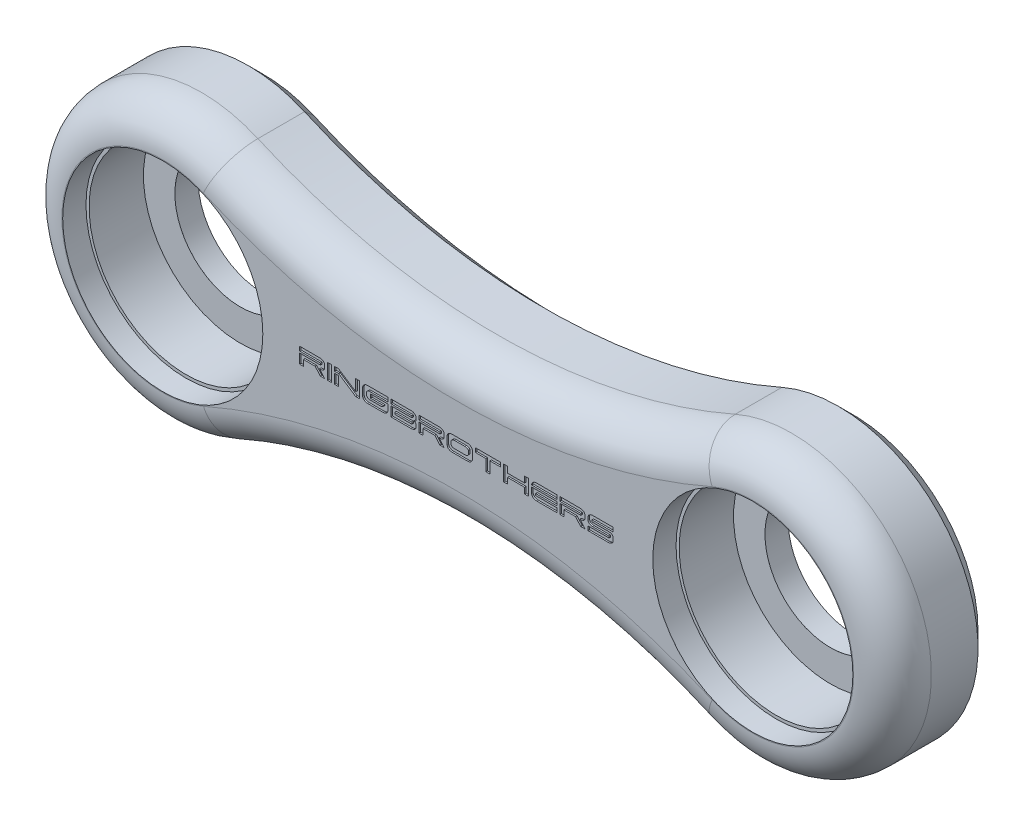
SolidWorks part; units mm, degrees
ref_plane "Front Plane" through (0, 0, 0) normal (0, 0, 1) x (1, 0, 0)
ref_plane "Top Plane" through (0, 0, 0) normal (0, 1, 0) x (1, 0, 0)
ref_plane "Right Plane" through (0, 0, 0) normal (1, 0, 0) x (0, 0, -1)
sketch "Sketch1" plane through (0, 0, 0) normal (0, 0, 1) x (1, 0, 0)
  line L0 (-11.43, 0) -> (59.69, 0) construction
  line L1 (-11.43, 6.35) -> (59.69, 6.35) construction
  arc A0 (4.6084, 10.4598) -> (4.6084, -10.4598) centre (0, 0) ccw
  arc A1 (43.6516, -10.4598) -> (43.6516, 10.4598) centre (48.26, 0) ccw
  arc A2 (4.6084, 10.4598) -> (43.6516, 10.4598) centre (24.13, 54.7687) ccw
  arc A3 (4.6084, -10.4598) -> (43.6516, -10.4598) centre (24.13, -54.7687) cw
  circle A4 centre (0, 0) radius 5.3594
  circle A5 centre (48.26, 0) radius 5.3594
  dimension "D1" = 22.86
  dimension "D4" = 10.7188
  dimension "D2" = 48.26
  dimension "D3" = 6.35
extrude "Main Body Dog Bone" add sketch "Sketch1" against normal blind 8.255
sketch "Sketch2" plane through (0, 0, 0) normal (0, 0, 1) x (1, 0, 0)
  circle A0 centre (0, 0) radius 7.9311
  circle A1 centre (48.26, 0) radius 7.9312
  dimension "D1" = 15.8623
extrude "R4ZZ bearin bore .3\" deep" cut sketch "Sketch2" against normal blind 6.35
sketch "Sketch3" plane through (0, 0, 0) normal (0, 0, 1) x (1, 0, 0)
  circle A2 centre (0, 0) radius 8.1852
  circle A3 centre (0, 0) radius 8.1852
  circle A5 centre (48.26, 0) radius 8.1852
  circle A6 centre (48.26, 0) radius 8.1852
  dimension "D1" = 0.254
  dimension "D2" = 0.254
extrude ".105\" deep Clearance Bore" cut sketch "Sketch3" against normal blind 1.905
chamfer ".02\" x 45 deg chamfers" distance 0.0003 angle 45 6 edges at (53.6194, 0, -8.255) (53.6194, 0, -6.35) (56.4451, 0, 0) (5.3594, 0, -8.255) (5.3594, 0, -6.35) (8.1852, 0, 0)
fillet ".125\" Fillets" radius 3.175 4 edges at (24.13, 6.35, 0) (24.13, -6.35, 0) (59.69, 0, 0) (-11.43, 0, 0)
sketch "Sketch4" [suppressed] plane through (0, 0, 0) normal (0, 0, 1) x (1, 0, 0)
  arc A3 (9.8505, 1.4938) -> (11.8659, 3.3473) centre (11.4829, 1.7413) cw
  arc A5 (43.0465, -5.4054) -> (5.2135, -5.4054) centre (24.13, -54.7687) ccw
  arc A6 (36.3941, -3.3473) -> (11.8659, -3.3473) centre (24.13, -54.7687) ccw
  arc A8 (6.496, -7.5542) -> (6.496, 7.5542) centre (0, 0) ccw
  arc A9 (9.8505, -1.4938) -> (9.8505, 1.4938) centre (0, 0) ccw
  arc A10 (5.2135, 5.4054) -> (43.0465, 5.4054) centre (24.13, 54.7687) ccw
  arc A11 (41.764, 7.5542) -> (41.764, -7.5542) centre (48.26, 0) ccw
  arc A12 (38.4095, 1.4938) -> (38.4095, -1.4938) centre (48.26, 0) ccw
  arc A13 (11.8659, 3.3473) -> (36.3941, 3.3473) centre (24.13, 54.7687) ccw
  arc A14 (11.8659, -3.3473) -> (9.8505, -1.4938) centre (11.4829, -1.7413) cw
  arc A15 (38.4095, -1.4938) -> (36.3941, -3.3473) centre (36.7771, -1.7413) cw
  arc A16 (38.4095, 1.4938) -> (36.3941, 3.3473) centre (36.7771, 1.7413) ccw
  dimension "D5" = 1.651
  dimension "D1" = 1.27
  dimension "D2" = 1.27
  dimension "D3" = 1.27
  dimension "D4" = 1.27
extrude "Extrude1" [suppressed] cut sketch "Sketch4" against normal blind 2.54
fillet ".03\" Fillets" [suppressed] radius 0.762
chamfer "Chamfer1" distance 1.27 angle 45 4 edges at (24.13, 6.35, -8.255) (-11.43, 0, -8.255) (59.69, 0, -8.255) (24.13, -6.35, -8.255)
sketch "Sketch5" plane through (0, 0, 0) normal (0, 0, 1) x (1, 0, 0)
  line L0 (0, 0) -> (48.26, 0) construction
  line L1 (0, -0.635) -> (48.26, -0.635) construction
  line L2 (0, 0.635) -> (48.26, 0.635) construction
  text T0 "RINGBROTHERS" font "Dodger" height 1.27
  dimension "D1" = 0.635
  dimension "D2" = 0.635
extrude "Extrude2" cut sketch "Sketch5" against normal blind 0.127
sketch "Sketch6" plane through (0, 0, 0) normal (0, 0, 1) x (1, 0, 0)
  arc A8 (4.6084, 10.4598) -> (4.6084, -10.4598) centre (0, 0) ccw construction
  arc A9 (4.6084, 10.4598) -> (43.6516, 10.4598) centre (24.13, 54.7687) ccw construction
  arc A10 (43.6516, -10.4598) -> (43.6516, 10.4598) centre (48.26, 0) ccw construction
  arc A11 (43.6516, -10.4598) -> (4.6084, -10.4598) centre (24.13, -54.7687) ccw construction
  arc A12 (4.6084, 10.4598) -> (4.6084, -10.4598) centre (0, 0) ccw
  arc A13 (4.6084, 10.4598) -> (43.6516, 10.4598) centre (24.13, 54.7687) ccw
  arc A14 (43.6516, -10.4598) -> (43.6516, 10.4598) centre (48.26, 0) ccw
  arc A15 (43.6516, -10.4598) -> (4.6084, -10.4598) centre (24.13, -54.7687) ccw
sketch "Sketch7" plane through (0, 0, -6.35) normal (0, 0, 1) x (1, 0, 0)
  circle A0 centre (0, 0) radius 5.3594 construction
  circle A1 centre (0, 0) radius 5.3594
sketch "Sketch8" plane through (0, 0, -6.35) normal (0, 0, 1) x (1, 0, 0)
  circle A0 centre (48.26, 0) radius 5.3594 construction
  circle A1 centre (48.26, 0) radius 5.3594
sketch "Sketch9" plane through (0, 0, 0) normal (0, 0, 1) x (1, 0, 0)
  circle A0 centre (48.26, 0) radius 8.1852 construction
  circle A1 centre (48.26, 0) radius 8.1852
sketch "Sketch10" plane through (0, 0, 0) normal (0, 0, 1) x (1, 0, 0)
  circle A0 centre (0, 0) radius 8.1852 construction
  circle A1 centre (0, 0) radius 8.1852
sketch "Sketch11" plane through (0, 0, -8.255) normal (0, 0, -1) x (-1, 0, 0)
  arc A0 (-43.6516, 10.4598) -> (-4.6084, 10.4598) centre (-24.13, 54.7687) ccw construction
  arc A1 (-43.6516, 10.4598) -> (-43.6516, -10.4598) centre (-48.26, 0) ccw construction
  arc A2 (-4.6084, -10.4598) -> (-43.6516, -10.4598) centre (-24.13, -54.7687) ccw construction
  arc A3 (-4.6084, -10.4598) -> (-4.6084, 10.4598) centre (0, 0) ccw construction
  arc A4 (-43.6516, 10.4598) -> (-4.6084, 10.4598) centre (-24.13, 54.7687) ccw
  arc A5 (-43.6516, 10.4598) -> (-43.6516, -10.4598) centre (-48.26, 0) ccw
  arc A6 (-4.6084, -10.4598) -> (-43.6516, -10.4598) centre (-24.13, -54.7687) ccw
  arc A7 (-4.6084, -10.4598) -> (-4.6084, 10.4598) centre (0, 0) ccw
sketch "Sketch12" plane through (0, 0, -8.255) normal (0, 0, -1) x (-1, 0, 0)
  circle A0 centre (0, 0) radius 5.3594 construction
  circle A1 centre (0, 0) radius 5.3594
sketch "Sketch13" plane through (0, 0, -8.255) normal (0, 0, -1) x (-1, 0, 0)
  circle A0 centre (-48.26, 0) radius 5.3594 construction
  circle A1 centre (-48.26, 0) radius 5.3594
sketch "Sketch14" plane through (0, 0, 0) normal (0, 0, 1) x (1, 0, 0)
  point P0 (0, 0)
  point P1 (48.26, 0)
sketch "Sketch16" plane through (0, 0, -8.255) normal (0, 0, -1) x (-1, 0, 0)
  line L1 (-100.33, 20.6375) -> (52.07, 20.6375)
  line L2 (-100.33, 20.6375) -> (-100.33, -20.6375)
  line L3 (-100.33, -20.6375) -> (52.07, -20.6375)
  line L4 (52.07, 20.6375) -> (52.07, -20.6375)
  line L5 (-100.33, 20.6375) -> (52.07, -20.6375) construction
  line L6 (-100.33, -20.6375) -> (52.07, 20.6375) construction
  arc A0 (-43.6516, 10.4598) -> (-4.6084, 10.4598) centre (-24.13, 54.7687) ccw construction
  arc A1 (-43.6516, 10.4598) -> (-43.6516, -10.4598) centre (-48.26, 0) ccw construction
  arc A2 (-4.6084, -10.4598) -> (-43.6516, -10.4598) centre (-24.13, -54.7687) ccw construction
  arc A3 (-4.6084, -10.4598) -> (-4.6084, 10.4598) centre (0, 0) ccw construction
  arc A4 (-43.6516, 10.4598) -> (-4.6084, 10.4598) centre (-24.13, 54.7687) ccw
  arc A5 (-43.6516, 10.4598) -> (-43.6516, -10.4598) centre (-48.26, 0) ccw
  arc A6 (-4.6084, -10.4598) -> (-43.6516, -10.4598) centre (-24.13, -54.7687) ccw
  arc A7 (-4.6084, -10.4598) -> (-4.6084, 10.4598) centre (0, 0) ccw
  point P0 (-24.13, -7.5341)
  dimension "D1" = 152.4
  dimension "D2" = 41.275
